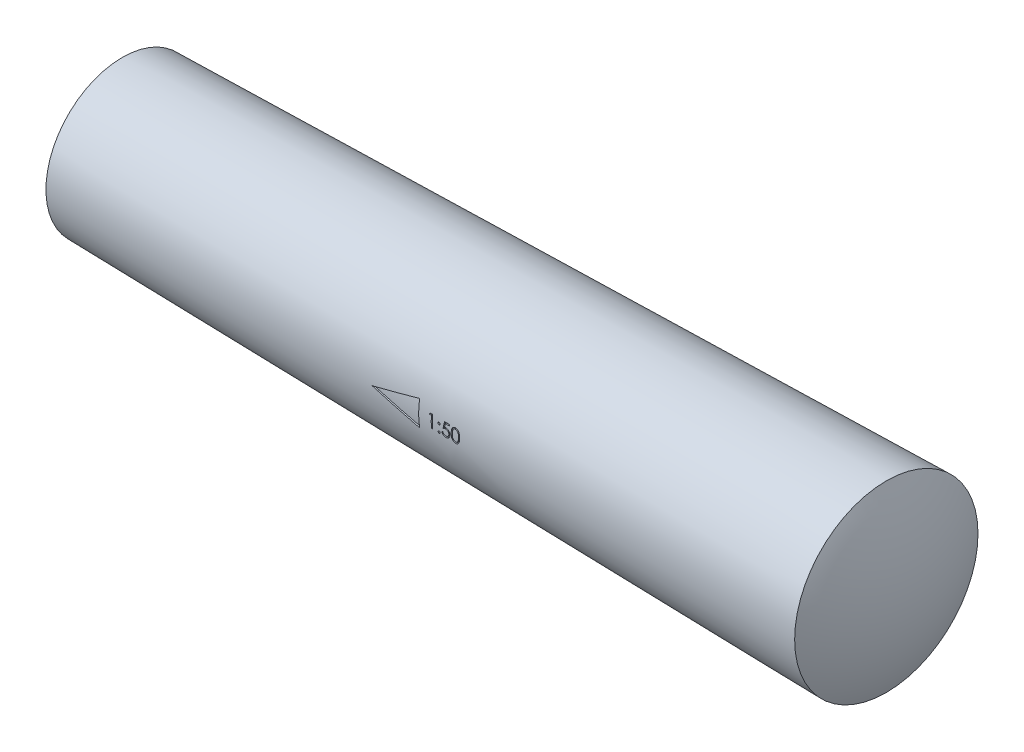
SolidWorks part; units mm, degrees
ref_plane "Front Plane" through (0, 0, 0) normal (0, 0, 1) x (1, 0, 0)
ref_plane "Top Plane" through (0, 0, 0) normal (0, 1, 0) x (1, 0, 0)
ref_plane "Right Plane" through (0, 0, 0) normal (1, 0, 0) x (0, 0, -1)
sketch "Sketch1" plane through (0, 0, 0) normal (1, 0, 0) x (0, 0, -1)
  circle A0 centre (0, 0) radius 6
  dimension "D1" = 12
extrude "Extrude1" add sketch "Sketch1" along normal mid plane 60
draft "Draft1" type of draft neutral plane draft angle 1.146 faces to draft 1 parameters "D1"=1.146
sketch "Sketch2" plane through (0, 0, 0) normal (0, 0, 1) x (1, 0, 0)
  line L0 (-30, 0) -> (-30, 6)
  line L1 (-30, 6) -> (-30, -6) construction
  line L2 (-30, 0) -> (-31.6, 0)
  line L3 (-31.6, 0) -> (-31.6, -6.6) construction
  line L4 (30, 0) -> (30, 7.2)
  line L5 (30, -7.2) -> (30, 7.2) construction
  line L6 (30, 0) -> (31.6, 0)
  line L7 (31.6, 0) -> (31.6, -6.6) construction
  line L8 (-30, -6) -> (30, -7.2) construction
  arc A0 (-31.6, 0) -> (-30, 6) centre (-19.55, 0) cw
  arc A1 (31.6, 0) -> (30, 7.2) centre (14.5998, 0) ccw
  point P14 (0, -6.6)
revolve "Revolve1" add sketch "Sketch2" angle 360 about L2
sketch "Sketch5" plane through (0, 0, 0) normal (0, 0, 1) x (1, 0, 0)
  line L0 (0, 6.6) -> (0, -6.6) construction
  line L1 (30, 7.2) -> (-30, 6) construction
  line L2 (-30, -6) -> (30, -7.2) construction
ref_plane "Plane2" through (0, 0, 0) normal (-0.02, 0, 0.9998) x (0.9998, 0, 0.02)
sketch "Sketch6" plane through (0, 0, 0) normal (-0.02, 0, 0.9998) x (0.9998, 0, 0.02)
  line L0 (0, 0) -> (0, 1)
  line L1 (0, 6.6) -> (0, -6.6) construction
  line L2 (0, 1) -> (-3.7321, 0)
  line L3 (-3.7321, 0) -> (0, -1)
  line L4 (0, -1) -> (0, 0)
  line L5 (0, -0.5) -> (4, -0.5) construction
  text T0 "1:50" font "Century Gothic" height 1
  dimension "D1" = 2
  dimension "D2" = 30
  dimension "D3" = 4
wrap "Wrap2" sketch "Sketch6" wrap type deboss source sketch "Sketch6" thickness 0.1 parameters "D1"=0.1
equation "\"D2@Sketch2\" = \"D1@Sketch2\""
